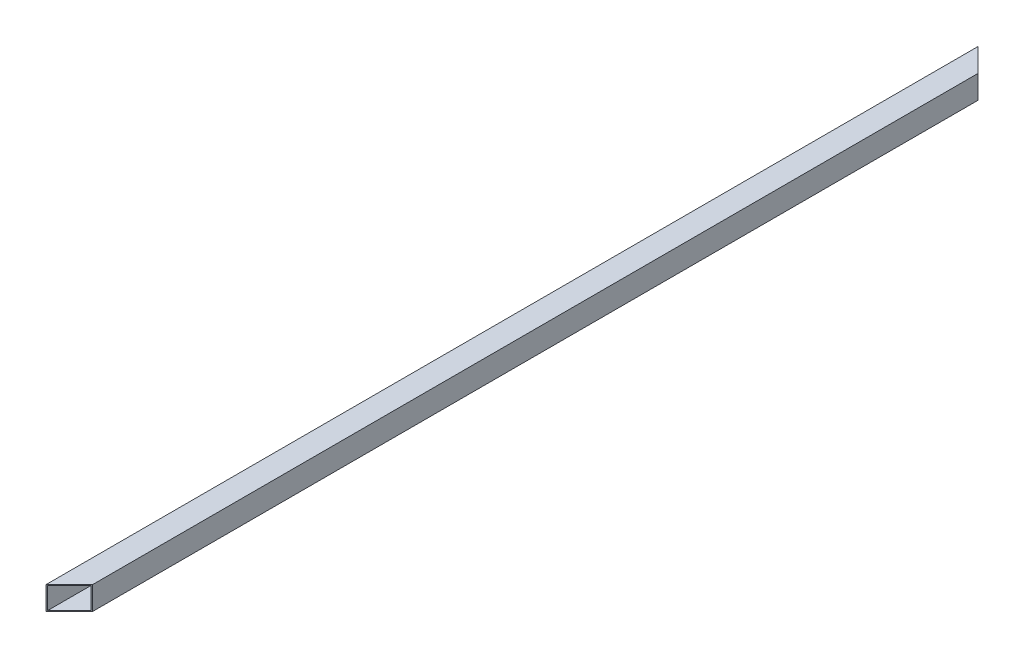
SolidWorks part; units mm, degrees
ref_plane "Piano frontale" through (0, 0, 0) normal (0, 0, 1) x (1, 0, 0)
ref_plane "Piano superiore" through (0, 0, 0) normal (0, 1, 0) x (1, 0, 0)
ref_plane "Piano destro" through (0, 0, 0) normal (1, 0, 0) x (0, 0, -1)
sketch "Schizzo1" plane through (0, 0, 0) normal (0, 0, 1) x (1, 0, 0)
  line L1 (-15, -15) -> (15, -15)
  line L2 (-15, -15) -> (-15, 15)
  line L3 (-15, 15) -> (15, 15)
  line L4 (15, -15) -> (15, 15)
  line L5 (-15, -15) -> (15, 15) construction
  line L6 (-15, 15) -> (15, -15) construction
  point P0 (0, 0)
  dimension "D1" = 30
  dimension "D2" = 30
extrude "Estrusione-Sottile1" add sketch "Schizzo1" along normal blind 1200 thin
ref_plane "Piano1" through (0, 0, 600) normal (0, 0, -1) x (-1, 0, 0)
sketch "Schizzo2" plane through (0, 15, 0) normal (0, 1, 0) x (1, 0, 0)
  line L0 (-15, 0) -> (15, -30)
  line L1 (15, -1200) -> (15, 0) construction
  line L2 (15, -30) -> (15, 0)
  line L3 (15, 0) -> (-15, 0)
  dimension "D1" = 45
extrude "Taglio-Estrusione1" cut sketch "Schizzo2" against normal up to next
mirror "Specchia1" about plane through (0, 0, 600) normal (0, 0, -1) of "Taglio-Estrusione1"
